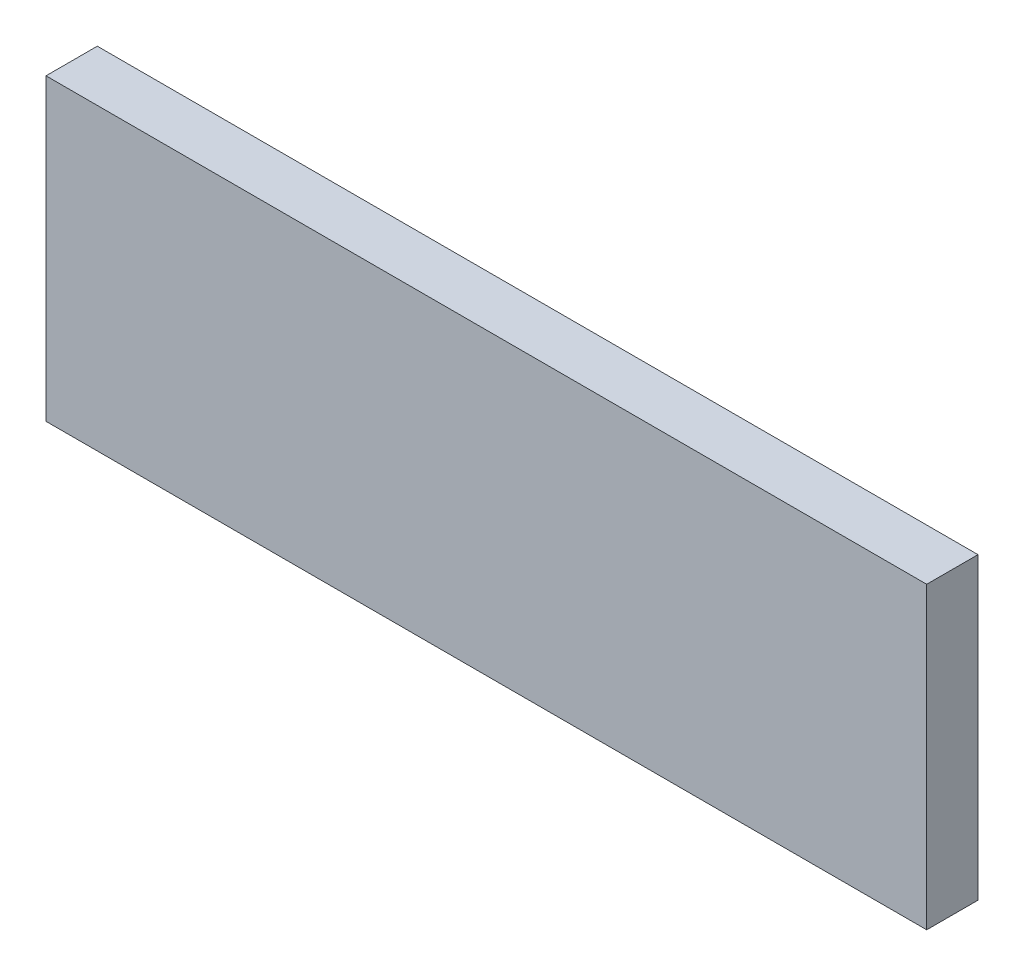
SolidWorks part; units mm, degrees
ref_plane "Face" through (0, 0, 0) normal (0, 0, 1) x (1, 0, 0)
ref_plane "Dessus" through (0, 0, 0) normal (0, 1, 0) x (1, 0, 0)
ref_plane "Droite" through (0, 0, 0) normal (1, 0, 0) x (0, 0, -1)
sketch "Esquisse1" plane through (0, 0, 0) normal (0, 0, 1) x (1, 0, 0)
  line L1 (-66.9469, 22.3689) -> (36.0531, 22.3689)
  line L2 (-66.9469, 22.3689) -> (-66.9469, -12.6311)
  line L3 (-66.9469, -12.6311) -> (36.0531, -12.6311)
  line L4 (36.0531, 22.3689) -> (36.0531, -12.6311)
  dimension "D1" = 103
  dimension "D2" = 35
extrude "Base-Extrusion" add sketch "Esquisse1" along normal blind 6
